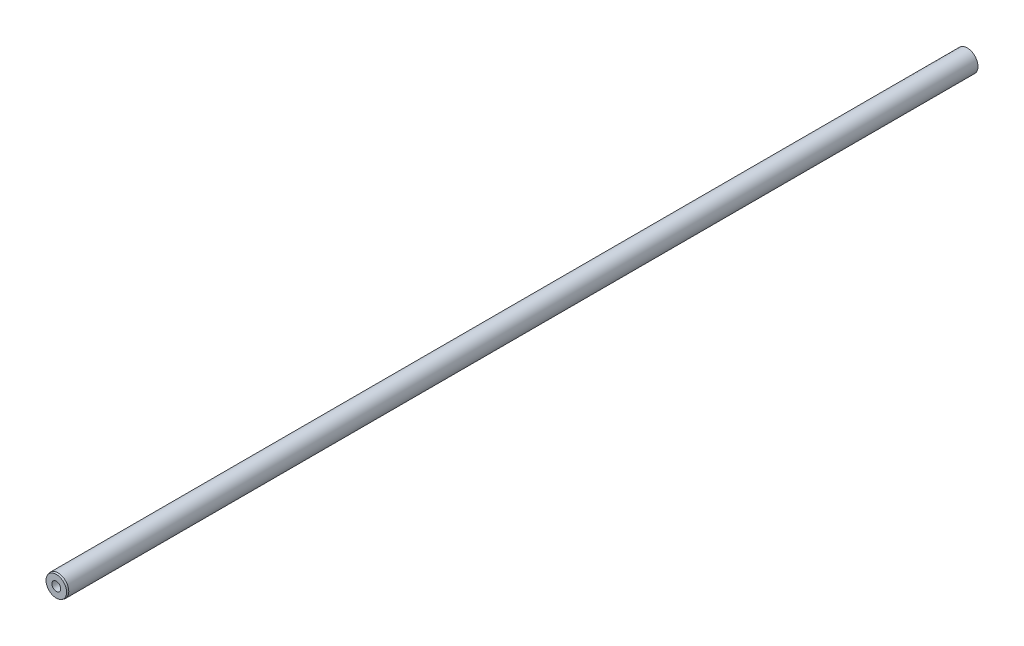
SolidWorks part; units mm, degrees
ref_plane "Front" through (0, 0, 0) normal (0, 0, 1) x (1, 0, 0)
ref_plane "Top" through (0, 0, 0) normal (0, 1, 0) x (1, 0, 0)
ref_plane "Right" through (0, 0, 0) normal (1, 0, 0) x (0, 0, -1)
sketch "Sketch1" plane through (0, 0, 0) normal (0, 0, 1) x (1, 0, 0)
  circle A0 centre (0, 0) radius 7.9375
  dimension "D1" = 15.875
extrude "Base-Extrude" add sketch "Sketch1" along normal blind 671.4744
chamfer "Chamfer1" distance 1.27 angle 15 1 edges at (7.9375, 0, 671.4744)
hole_wizard "5/16-18 Tapped Hole1" positions "Sketch3" profile "Sketch2"
sketch "Sketch3" plane through (0, 0, 671.4744) normal (0, 0, 1) x (1, 0, 0)
  point P0 (0, 0)
sketch "Sketch2" plane through (0, 0, 671.4744) normal (1, 0, 0) x (0, -1, 0)
  line L0 (0, 0) -> (0, 17.8361)
  line L1 (0, 17.8361) -> (3.2639, 15.875)
  line L2 (3.2639, 15.875) -> (3.2639, 0.0025)
  line L3 (3.2639, 0.0025) -> (3.2639, 0)
  line L5 (3.2639, 0) -> (0, 0)
  line L6 (-3.2639, 0.0025) -> (-3.2639, 0) construction
  line L10 (0, 17.8361) -> (-3.2639, 15.875) construction
  line L11 (0, -6.35) -> (0, 107.95) construction
